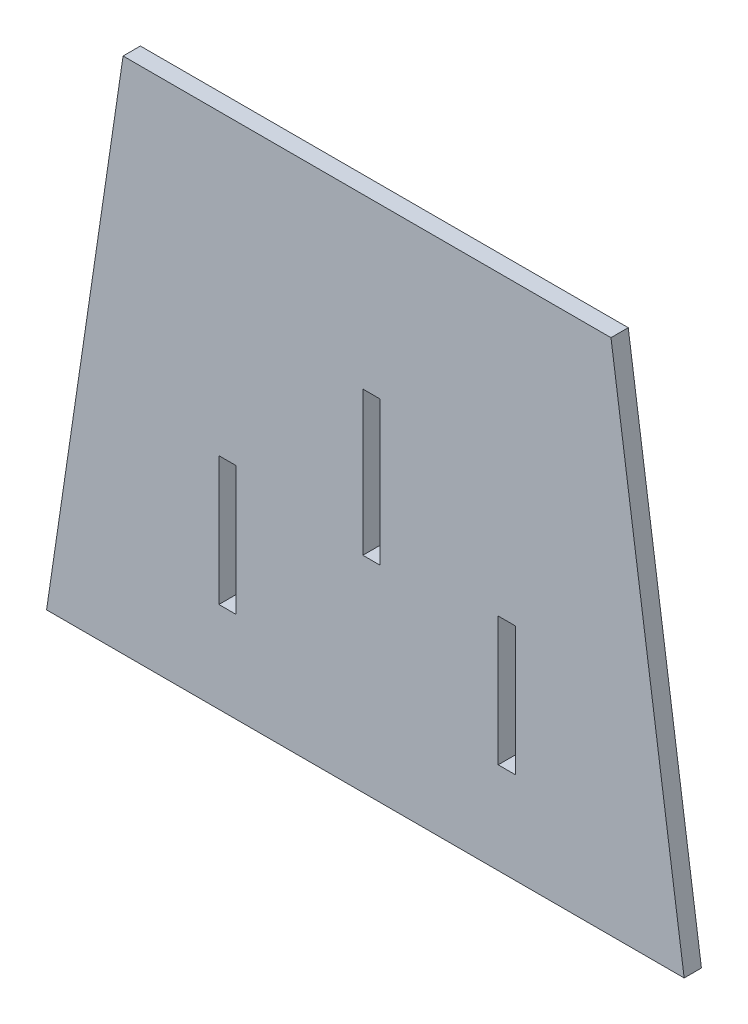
SolidWorks part; units mm, degrees
ref_plane "Front Plane" through (0, 0, 0) normal (0, 0, 1) x (1, 0, 0)
ref_plane "Top Plane" through (0, 0, 0) normal (0, 1, 0) x (1, 0, 0)
ref_plane "Right Plane" through (0, 0, 0) normal (1, 0, 0) x (0, 0, -1)
sketch "Sketch1" plane through (0, 0, 0) normal (0, 0, 1) x (1, 0, 0)
  line L0 (0.762, 6.2713) -> (0.762, -66.8348) construction
  line L1 (1.524, 6.2713) -> (0, 6.2713)
  line L2 (1.524, 6.2713) -> (1.524, 18.9713)
  line L3 (1.524, 18.9713) -> (0, 18.9713)
  line L4 (0, 6.2713) -> (0, 18.9713)
  line L5 (28.3438, -11.8526) -> (-27.9022, -11.8526)
  line L6 (-27.9022, -11.8526) -> (-21.1524, 33.839)
  line L7 (-21.1524, 33.839) -> (21.8872, 33.839)
  line L8 (21.8872, 33.839) -> (28.3438, -11.8526)
extrude "Boss-Extrude1" add sketch "Sketch1" along normal blind 1.524
sketch "Sketch2" plane through (0, 0, 1.524) normal (0, 0, 1) x (1, 0, 0)
  line L2 (13.462, 7.6009) -> (11.938, 7.6009)
  line L3 (13.462, 7.6009) -> (13.462, -3.7695)
  line L4 (11.938, 7.6009) -> (11.938, -3.7695)
  line L5 (11.938, -3.7695) -> (13.462, -3.7695)
  line L7 (-11.1758, -3.8401) -> (-12.6998, -3.8401)
  line L8 (-11.1758, 7.5303) -> (-11.1758, -3.8401)
  line L9 (-12.6998, 7.5303) -> (-12.6998, -3.8401)
  line L10 (-12.6998, 7.5303) -> (-11.1758, 7.5303)
  circle A0 centre (0.762, 12.6213) radius 11.176 construction
  point P0 (0.762, 18.9713)
  point P1 (0.762, -3.7695)
extrude "Cut-Extrude1" cut sketch "Sketch2" against normal blind 2.54
